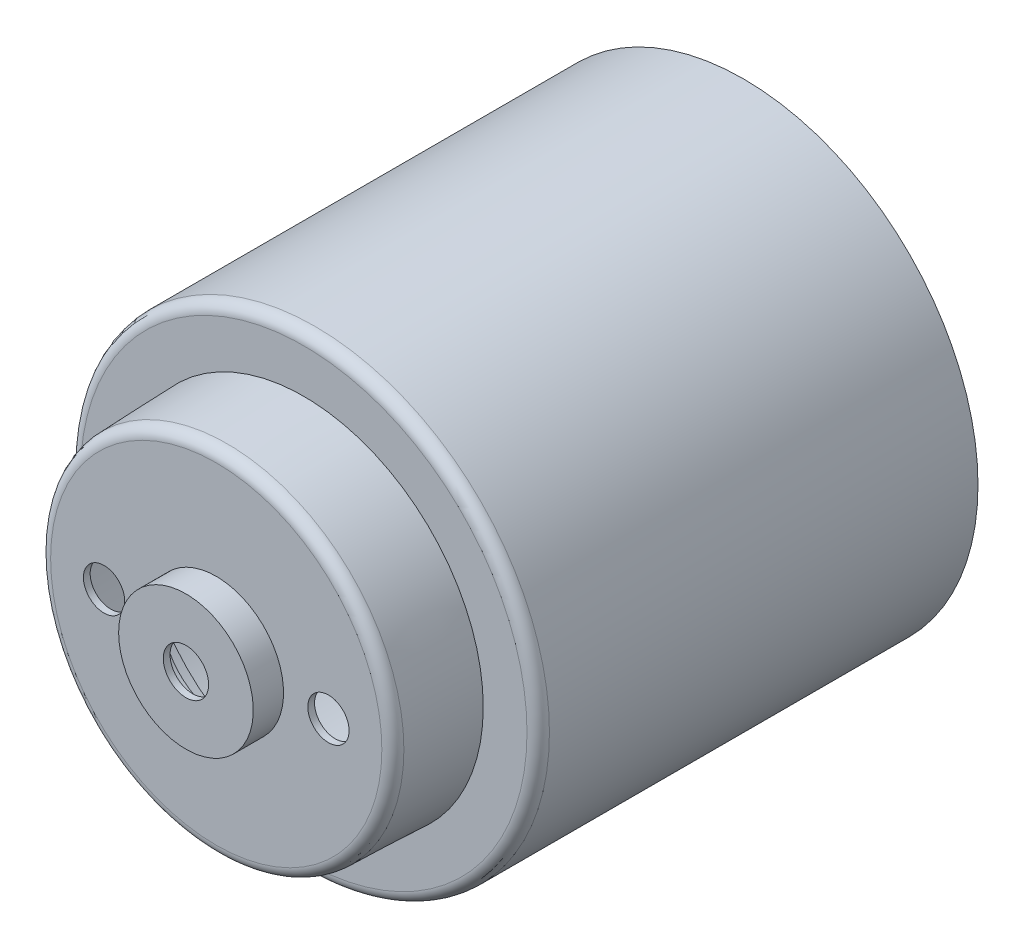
SolidWorks part; units mm, degrees
ref_plane "Face" through (0, 0, 0) normal (0, 0, 1) x (1, 0, 0)
ref_plane "Dessus" through (0, 0, 0) normal (0, 1, 0) x (1, 0, 0)
ref_plane "Droite" through (0, 0, 0) normal (1, 0, 0) x (0, 0, -1)
sketch "Esquisse1" plane through (0, 0, 0) normal (0, 0, 1) x (1, 0, 0)
  circle A0 centre (0, 0) radius 10.45
extrude "Base-Extrusion" add sketch "Esquisse1" along normal blind 19.6
sketch "Esquisse2" plane through (0, 0, 19.6) normal (0, 0, 1) x (1, 0, 0)
  circle A0 centre (0, 0) radius 8
extrude "Boss.-Extru.1" add sketch "Esquisse2" along normal blind 3.9
sketch "Esquisse3" plane through (0, 0, 23.5) normal (0, 0, 1) x (1, 0, 0)
  circle A0 centre (0, 0) radius 3
extrude "Boss.-Extru.2" add sketch "Esquisse3" along normal blind 1.35
draft "Dépouille1" type of draft neutral plane draft angle 2 faces to draft 1 parameters "D1"=2
fillet "Congé2" radius 0.5 1 edges at (7.8638, 0, 23.5)
fillet "Congé3" radius 0.5 1 edges at (10.45, 0, 19.6)
shell "Coque1" thickness 0.3
sketch "Esquisse4" plane through (0, 0, 24.85) normal (0, 0, 1) x (1, 0, 0)
  line L0 (-12.639, 0) -> (12.8025, 0) construction
  line L1 (-5, 4.4637) -> (-5, -3.7443) construction
  line L2 (5, 4.6926) -> (5, -2.7632) construction
  line L3 (0, 5.4774) -> (0, -7.0471) construction
  circle A0 centre (0, 0) radius 1.01
  circle A1 centre (-5, 0) radius 0.92
  circle A2 centre (5, 0) radius 0.92
extrude "Enlèv. mat.-Extru.1" cut sketch "Esquisse4" against normal through all
